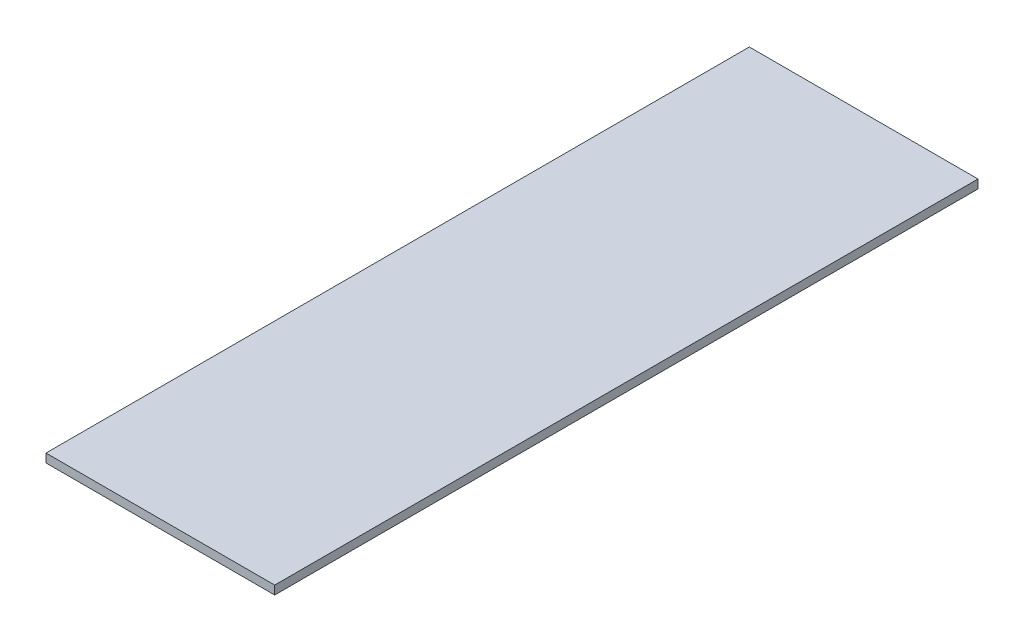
SolidWorks part; units mm, degrees
ref_plane "Front Plane" through (0, 0, 0) normal (0, 0, 1) x (1, 0, 0)
ref_plane "Top Plane" through (0, 0, 0) normal (0, 1, 0) x (1, 0, 0)
ref_plane "Right Plane" through (0, 0, 0) normal (1, 0, 0) x (0, 0, -1)
sketch "Sketch1" plane through (0, 0, 0) normal (0, 0, 1) x (1, 0, 0)
  line L1 (-265, -10) -> (265, -10)
  line L2 (-265, -10) -> (-265, 10)
  line L3 (-265, 10) -> (265, 10)
  line L4 (265, -10) -> (265, 10)
  line L5 (-265, -10) -> (265, 10) construction
  line L6 (-265, 10) -> (265, -10) construction
  point P0 (0, 0)
  dimension "D1" = 530
  dimension "D2" = 20
extrude "Boss-Extrude1" add sketch "Sketch1" along normal mid plane 1630
